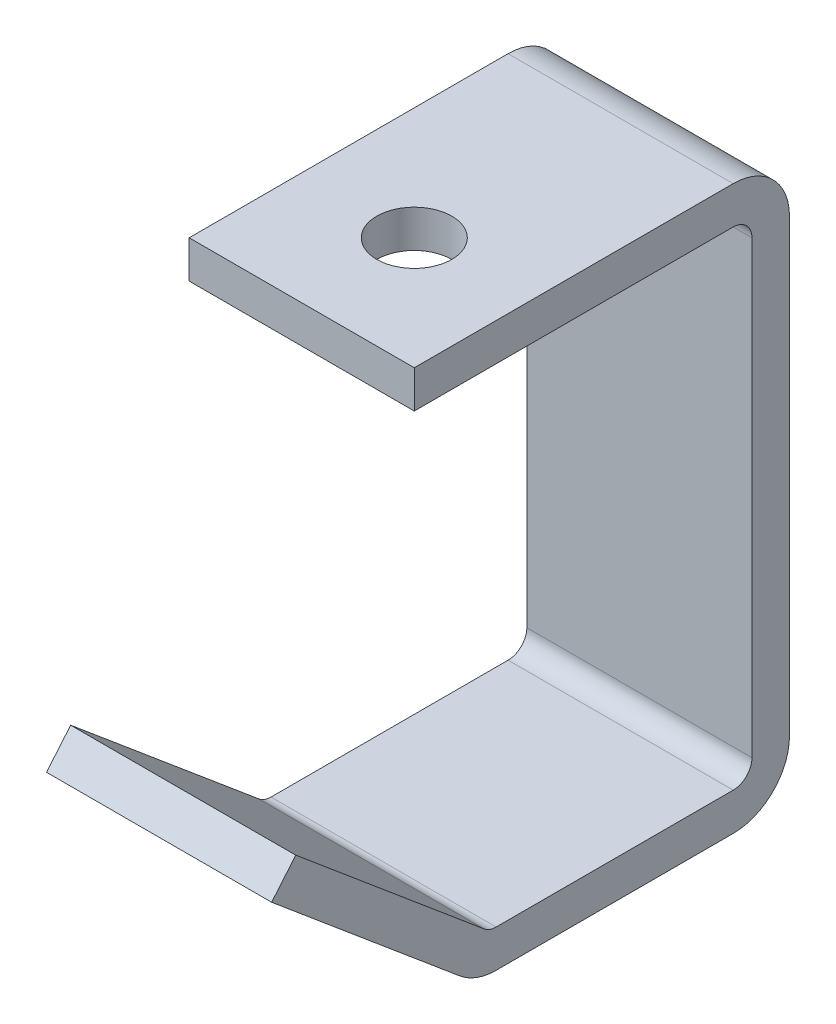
SolidWorks part; units mm, degrees
ref_plane "Front" through (0, 0, 0) normal (0, 0, 1) x (1, 0, 0)
ref_plane "Top" through (0, 0, 0) normal (0, 1, 0) x (-1, 0, 0)
ref_plane "Right" through (0, 0, 0) normal (1, 0, 0) x (0, 0, -1)
sketch "Sketch1" plane through (0, 0, 0) normal (1, 0, 0) x (0, 0, -1)
  line L0 (-57.15, 82.55) -> (0, 82.55)
  line L1 (-57.15, 82.55) -> (-57.15, 51.3934)
  line L2 (0, 82.55) -> (0, 0)
  line L3 (-77.209, 27.488) -> (-44.45, 0)
  line L4 (-44.45, 0) -> (0, 0)
  line L5 (-77.209, 27.488) -> (-57.15, 51.3934)
  dimension "D1" = 40
  dimension "D2" = 82.55
  dimension "D3" = 44.45
  dimension "D4" = 42.7638
  dimension "D5" = 57.15
extrude "Boss-Extrude1" add sketch "Sketch1" along normal mid plane 38.1
shell "Shell1" thickness 6.35
fillet "Fillet1" radius 3.175 3 edges at (0, 0, 0) (0, 82.55, 0) (0, 0, 44.45)
fillet "Fillet2" radius 9.525 3 edges at (0, 88.9, -6.35) (0, -6.35, 46.7612) (0, -6.35, -6.35)
sketch "Sketch2" plane through (0, 88.9, 0) normal (0, 1, 0) x (-1, 0, 0)
  line L0 (-19.05, 57.15) -> (19.05, 57.15) construction
  circle A0 centre (0, 38.1) radius 6.35
  point P4 (0, 57.15)
  dimension "D1" = 12.7
  dimension "D2" = 19.05
extrude "Cut-Extrude1" cut sketch "Sketch2" against normal up to next
